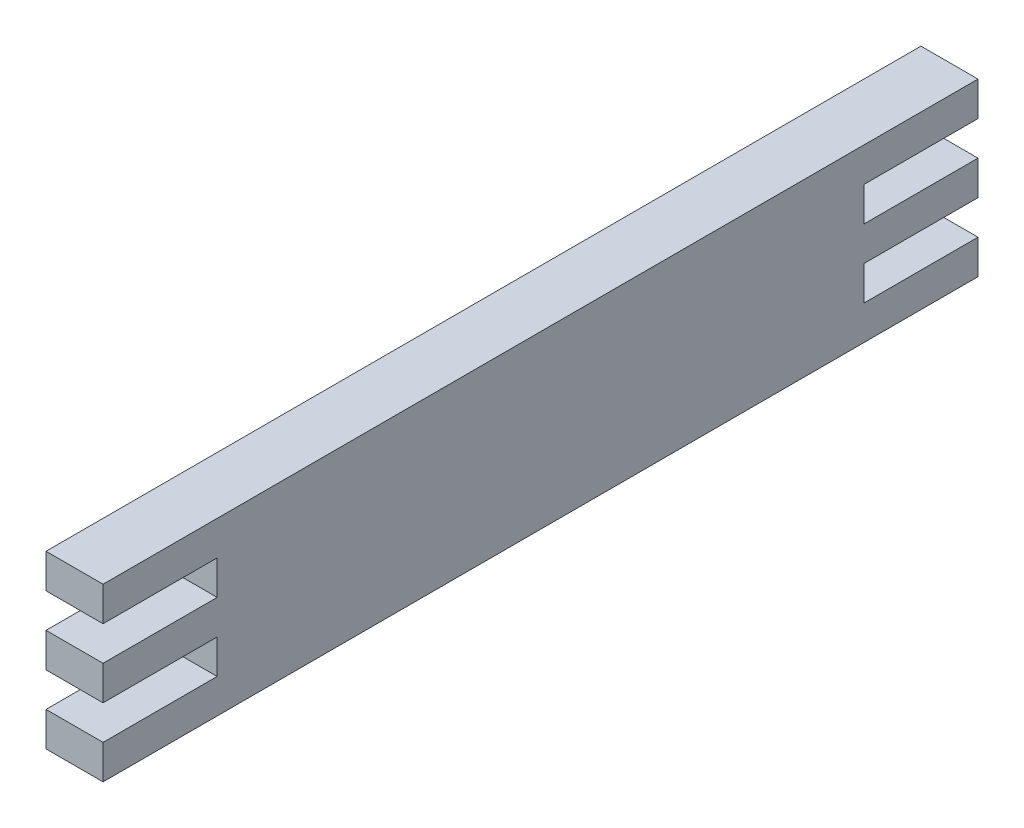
SolidWorks part; units mm, degrees
ref_plane "Front Plane" through (0, 0, 0) normal (0, 0, 1) x (1, 0, 0)
ref_plane "Top Plane" through (0, 0, 0) normal (0, 1, 0) x (1, 0, 0)
ref_plane "Right Plane" through (0, 0, 0) normal (1, 0, 0) x (0, 0, -1)
sketch "Sketch1" plane through (0, 0, 0) normal (1, 0, 0) x (0, 0, -1)
  line L1 (-23, -4.5) -> (23, -4.5)
  line L2 (-23, -4.5) -> (-23, 4.5)
  line L3 (-23, 4.5) -> (23, 4.5)
  line L4 (23, -4.5) -> (23, 4.5)
  line L5 (-23, -4.5) -> (23, 4.5) construction
  line L6 (-23, 4.5) -> (23, -4.5) construction
  point P0 (0, 0)
  dimension "D1" = 46
  dimension "D2" = 9
extrude "Boss-Extrude1" add sketch "Sketch1" along normal blind 3
sketch "Sketch2" plane through (3, 0, 0) normal (1, 0, 0) x (0, 0, -1)
  line L0 (-23, 4.5) -> (-23, -4.5) construction
  line L1 (-17, 2.7) -> (-23, 2.7)
  line L2 (-17, 2.7) -> (-17, 0.9)
  line L3 (-17, 0.9) -> (-23, 0.9)
  line L4 (-23, 2.7) -> (-23, 0.9)
  line L5 (23, -4.5) -> (23, 4.5) construction
  line L6 (-17, -0.9) -> (-23, -0.9)
  line L7 (-17, -0.9) -> (-17, -2.7)
  line L8 (-17, -2.7) -> (-23, -2.7)
  line L9 (-23, -0.9) -> (-23, -2.7)
  line L10 (17, -0.9) -> (23, -0.9)
  line L11 (17, -0.9) -> (17, -2.7)
  line L12 (17, -2.7) -> (23, -2.7)
  line L13 (23, -0.9) -> (23, -2.7)
  line L14 (23, 0.9) -> (17, 0.9)
  line L15 (23, 0.9) -> (23, 2.7)
  line L16 (23, 2.7) -> (17, 2.7)
  line L17 (17, 0.9) -> (17, 2.7)
  dimension "D1" = 6
  dimension "D2" = 6
extrude "Cut-Extrude1" cut sketch "Sketch2" against normal blind 10
